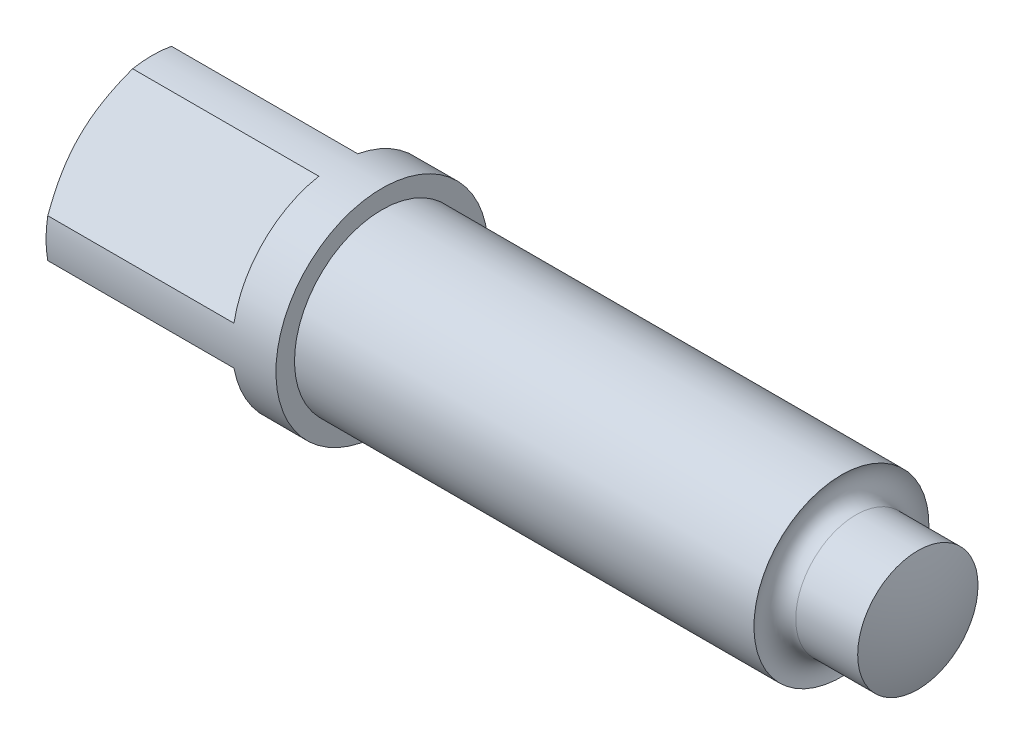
SolidWorks part; units mm, degrees
ref_plane "Front" through (0, 0, 0) normal (0, 0, 1) x (1, 0, 0)
ref_plane "Top" through (0, 0, 0) normal (0, 1, 0) x (1, 0, 0)
ref_plane "Right" through (0, 0, 0) normal (1, 0, 0) x (0, 0, -1)
sketch "Sketch1" plane through (0, 0, 0) normal (1, 0, 0) x (0, 0, -1)
  circle A0 centre (0, 0) radius 4.85
  dimension "e" = 9.7
extrude "BaseHead" add sketch "Sketch1" along normal blind 11
sketch "Sketch2" plane through (0, -0.4747, 1.6499) normal (-1, 0, 0) x (0, 0, 1)
  line L1 (4.007, 0.4747) -> (-1.6499, 6.1315)
  line L2 (-1.6499, 6.1315) -> (-7.3067, 0.4747)
  line L3 (-7.3067, 0.4747) -> (-1.6499, -5.1822)
  line L4 (-1.6499, -5.1822) -> (4.007, 0.4747)
  circle A0 centre (-1.6499, 0.4747) radius 4 construction
  dimension "s" = 8
extrude "Cut-Extrude1" cut sketch "Sketch2" against normal blind 9 flip side to cut
sketch "Sketch3" plane through (2.6897, -8.0247, 0) normal (0, 0, 1) x (0, -1, 0)
  line L0 (-13.3597, -2.6897) -> (-12.0247, -2.6897)
  line L2 (-12.0247, -2.6897) -> (-13.3597, -1.919)
  line L3 (-13.3597, -1.919) -> (-13.3597, -2.6897)
  line L4 (-8.0247, 0.2856) -> (-8.0247, -6.82) construction
  line L6 (-7.1357, -2.6897) -> (-3.2569, -2.6897) construction
  dimension "D1" = 10.67
  dimension "d2" = 8
  dimension "D3" = 30
revolve "Cut-Revolve1" cut sketch "Sketch3" angle 360 about L4
sketch "Sketch4" plane through (-9.8802, 13.8802, 0) normal (0, 0, 1) x (0, -1, 0)
  line L0 (13.8802, 20.8802) -> (17.8802, 20.8802)
  line L1 (17.8802, 24.6302) -> (13.8802, 24.6302) construction
  line L2 (17.8802, 20.8802) -> (17.8802, 41.8802)
  line L3 (18.7302, 20.8802) -> (9.0302, 20.8802) construction
  line L4 (16.6302, 42.5416) -> (16.6302, 45.3724)
  line L5 (13.8802, 45.8802) -> (13.8802, 20.8802)
  line L6 (13.8802, 12.6966) -> (13.8802, -1.2396) construction
  arc A0 (16.6302, 45.3724) -> (13.8802, 45.8802) centre (13.8802, 38.1802) ccw
  arc A1 (16.6302, 42.5416) -> (17.8802, 41.8802) centre (17.4302, 42.5416) ccw
  dimension "D2" = 0.8
  dimension "re" = 7.7
  dimension "d" = 8
  dimension "l" = 25
  dimension "dp" = 5.5
  dimension "z" = 4
  dimension "a" = 3.75
revolve "BaseBody" add sketch "Sketch4" angle 360 about L6
fillet "HeadFillet" [suppressed] radius 0.4
sketch "Sketch5" plane through (0, 0, 0) normal (0, 0, 1) x (1, 0, 0)
  line L0 (32, 3.134) -> (32.5, 4)
  line L1 (32.5, 4) -> (32.5, 5)
  line L2 (32.5, 5) -> (31.5, 5)
  line L3 (31.5, 5) -> (31.5, 4)
  line L4 (31.5, 4) -> (32, 3.134)
  line L5 (32, 4) -> (32, -4) construction
  line L6 (0, 0) -> (37.4265, 0) construction
  dimension "D1" = 8
  dimension "D2" = 1
revolve "Cut-Revolve10" [suppressed] cut sketch "Sketch5" angle 360 about L6
pattern_linear "LPattern10" [suppressed] count 14 spacing 1.2 along (1, 0, 0)
equation "\"D1@Sketch3\" = \"e@Sketch1\" * 1.1"
equation "\"d2@Sketch3\" = \"s@Sketch2\""
equation "\"D2@Sketch4\" = \"r@HeadFillet\" * 2"
equation "\"D1@ThreadCosmetic1\" = \"l@Sketch4\" - \"a@Sketch4\" - \"z@Sketch4\""
equation "\"D1@Sketch5\" = \"d@Sketch4\""
equation "\"D2@Sketch5\" =  ( \"d@Sketch4\" - \"D@ThreadCosmetic1\" )  / 2"
equation "\"D3@LPattern10\" = \"D2@Sketch5\" * 1.2"
equation "\"D1@LPattern10\" = \"D1@ThreadCosmetic1\" / \"D3@LPattern10\""
